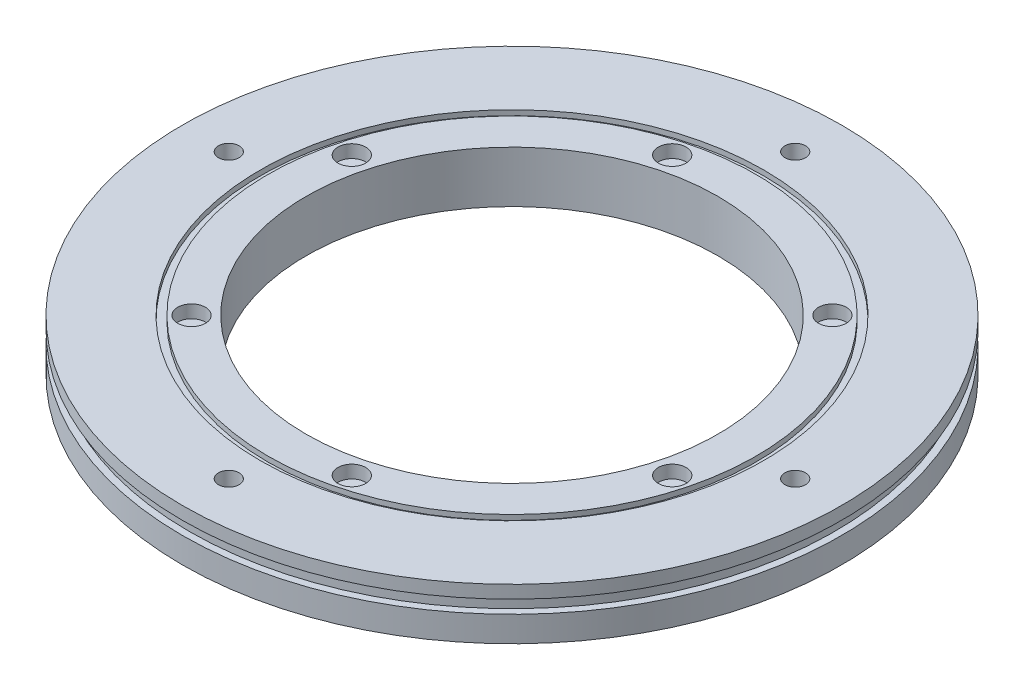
SolidWorks part; units mm, degrees
ref_plane "Front Plane" through (0, 0, 0) normal (0, 0, 1) x (1, 0, 0)
ref_plane "Top Plane" through (0, 0, 0) normal (0, 1, 0) x (1, 0, 0)
ref_plane "Right Plane" through (0, 0, 0) normal (1, 0, 0) x (0, 0, -1)
sketch "Sketch1" plane through (0, 0, 0) normal (0, 1, 0) x (1, 0, 0)
  circle A0 centre (0, 0) radius 81.28
  dimension "D1" = 162.56
extrude "Boss-Extrude1" add sketch "Sketch1" along normal blind 12.7
sketch "Sketch2" plane through (0, 12.7, 0) normal (0, 1, 0) x (1, 0, 0)
  circle A0 centre (0, 0) radius 50.8
  dimension "D1" = 101.6
extrude "Cut-Extrude1" cut sketch "Sketch2" against normal through all
sketch "Sketch3" plane through (0, 0, 0) normal (0, 1, 0) x (1, 0, 0)
  line L0 (0, 0) -> (0, 69.85) construction
  line L1 (69.85, 0) -> (0, 0) construction
  line L2 (0, 0) -> (69.85, 0) construction
  line L3 (0, -69.85) -> (0, 0) construction
  circle A0 centre (0, 69.85) radius 6.35
  circle A1 centre (69.85, 0) radius 6.35
  circle A2 centre (0, -69.85) radius 6.35
  circle A3 centre (-69.85, 0) radius 6.35
  point P13 (0, 0)
  dimension "D1" = 12.7
  dimension "D2" = 69.85
  dimension "D3" = 4
extrude "Cut-Extrude2" cut sketch "Sketch3" along normal blind 6.35 contours A1
ref_plane "Plane1" through (0, 9.525, 0) normal (0, 1, 0) x (1, 0, 0)
sketch "Sketch4" plane through (0, 9.525, 0) normal (0, 1, 0) x (1, 0, 0)
  circle A0 centre (0, 0) radius 81.28 construction
  circle A1 centre (0, 0) radius 79.5782
  circle A2 centre (0, 0) radius 81.28 construction
  circle A3 centre (0, 0) radius 101.6
  dimension "D1" = 1.7018
  dimension "D2" = 203.2
extrude "Cut-Extrude3" cut sketch "Sketch4" against normal blind 3.2258 contours A3
sketch "Sketch5" plane through (0, 0, 0) normal (0, -1, 0) x (1, 0, 0)
  line L0 (0, 0) -> (0, 50.8) construction
  line L1 (0, 0) -> (-39.5131, 39.5131) construction
  line L2 (0, 0) -> (53.9759, 14.4628) construction
  line L3 (0, 0) -> (-14.4628, -53.9759) construction
  line L4 (0, 0) -> (39.5131, -39.5131) construction
  line L5 (0, 0) -> (-53.9759, -14.4628) construction
  circle A0 centre (-39.5131, 39.5131) radius 3.175
  circle A1 centre (0, 0) radius 50.8 construction
  circle A2 centre (0, 0) radius 63.5 construction
  circle A3 centre (14.4628, 53.9759) radius 3.175
  circle A4 centre (53.9759, 14.4628) radius 3.175
  circle A5 centre (39.5131, -39.5131) radius 3.175
  circle A6 centre (-14.4628, -53.9759) radius 3.175
  circle A7 centre (-53.9759, -14.4628) radius 3.175
  point P21 (0, 0)
  dimension "D2" = 6.35
  dimension "D3" = 127
  dimension "D1" = 45
  dimension "D4" = 55.88
  dimension "D5" = 6
extrude "Cut-Extrude4" cut sketch "Sketch5" against normal blind 7.62 contours A0
hole_wizard "#10 Clearance Hole1" positions "Sketch6" profile "Sketch7" hole size "#10" standard "ANSI Inch"
sketch "Sketch6" plane through (0, 6.35, 0) normal (0, -1, 0) x (-1, 0, 0)
  point P0 (0, 69.85)
  point P3 (69.85, 0)
  point P6 (0, -69.85)
  point P9 (-69.85, 0)
sketch "Sketch7" plane through (0, 6.35, -69.85) normal (1, 0, 0) x (0, 0, -1)
  line L0 (0, 0) -> (0, 6.35)
  line L1 (0, 6.35) -> (2.5527, 6.35)
  line L2 (2.5527, 6.35) -> (2.5527, 0)
  line L5 (2.5527, 0) -> (0, 0)
  line L11 (0, -6.35) -> (0, 107.95) construction
  dimension "Thru Hole Dia." = 5.1054
  dimension "Thru Hole Depth" = 6.35
sketch "Sketch8" plane through (0, 12.7, 0) normal (0, 1, 0) x (1, 0, 0)
  circle A0 centre (0, 0) radius 62.0903
  circle A1 centre (0, 0) radius 60.1853
  dimension "D1" = 120.3706
  dimension "D2" = 1.905
extrude "Cut-Extrude5" cut sketch "Sketch8" against normal blind 1.27
sketch "Sketch9" plane through (0, 12.7, 0) normal (0, 1, 0) x (1, 0, 0)
  line L0 (0, 0) -> (-14.4628, 53.9759) construction
  line L1 (0, 0) -> (-53.9759, 14.4628) construction
  line L2 (0, 0) -> (0, 69.85) construction
  line L3 (0, 0) -> (39.5131, 39.5131) construction
  line L4 (0, 0) -> (53.9759, -14.4628) construction
  line L5 (0, 0) -> (14.4628, -53.9759) construction
  line L6 (0, 0) -> (-39.5131, -39.5131) construction
  circle A2 centre (53.9759, -14.4628) radius 3.429
  circle A4 centre (14.4628, -53.9759) radius 3.429
  circle A6 centre (-39.5131, -39.5131) radius 3.429
  circle A8 centre (-53.9759, 14.4628) radius 3.429
  circle A10 centre (-14.4628, 53.9759) radius 3.429
  circle A12 centre (39.5131, 39.5131) radius 3.429
  dimension "D7" = 6.858
  dimension "D1" = 75
  dimension "D2" = 60
  dimension "D3" = 120
  dimension "D4" = 55.88
  dimension "D5" = 45
  dimension "D6" = 60
extrude "Cut-Extrude6" cut sketch "Sketch9" against normal blind 3.175
